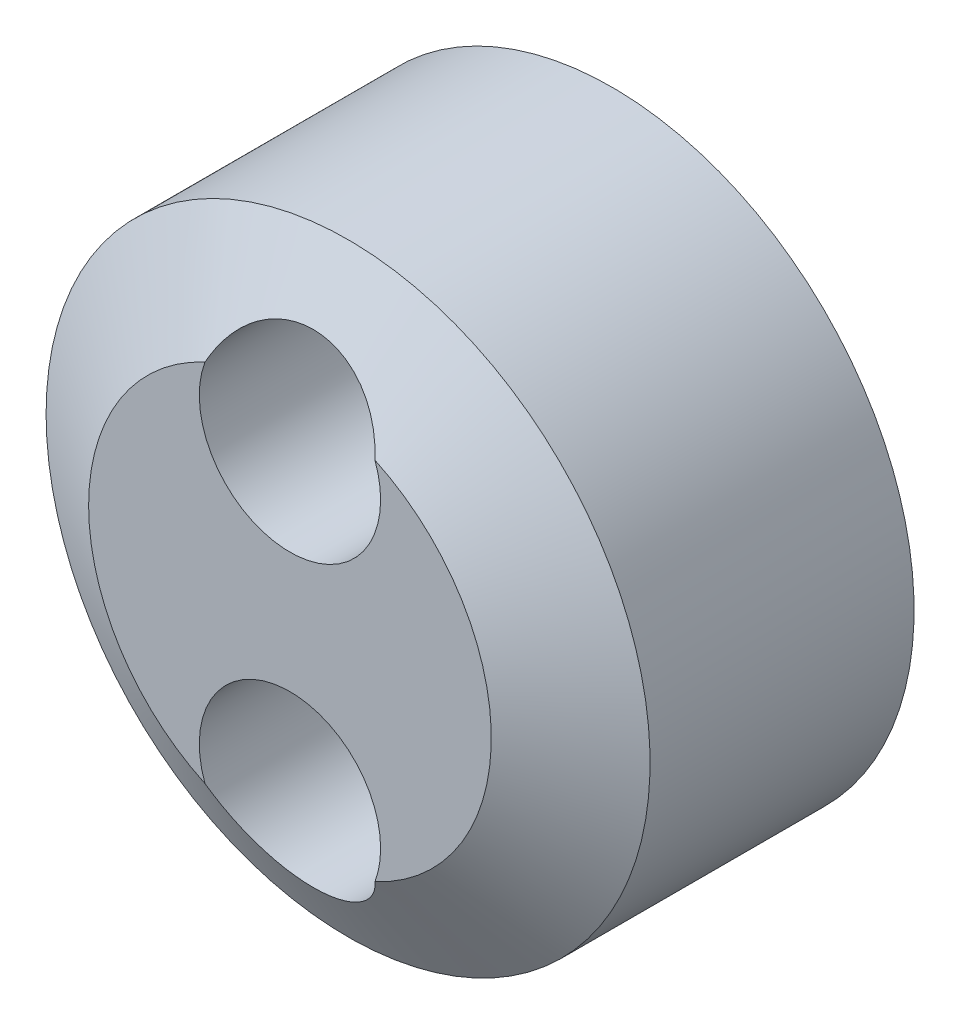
SolidWorks part; units mm, degrees
ref_plane "Plan de face" through (0, 0, 0) normal (0, 0, 1) x (1, 0, 0)
ref_plane "Plan de dessus" through (0, 0, 0) normal (0, 1, 0) x (1, 0, 0)
ref_plane "Plan de droite" through (0, 0, 0) normal (1, 0, 0) x (0, 0, -1)
sketch "Esquisse1" plane through (0, 0, 0) normal (0, 0, 1) x (1, 0, 0)
  circle A0 centre (0, 0) radius 30
  dimension "D1" = 60
extrude "Extrusion1" add sketch "Esquisse1" along normal blind 32
hole_wizard "Chambrage pour vis à tête hexagonale à filetage réduit M81" positions "Esquisse3" profile "Esquisse2" counterbore size "M8" standard "Ansi Métrique"
sketch "Esquisse3" plane through (0, 0, 32) normal (0, 0, 1) x (1, 0, 0)
  point P0 (0, 15)
  point P1 (0, -15)
  dimension "D1" = 30
  dimension "D2" = 15
sketch "Esquisse2" plane through (0, 15, 32) normal (1, 0, 0) x (0, -1, 0)
  line L0 (0, 0) -> (0, 32)
  line L1 (0, 32) -> (4.5, 32)
  line L3 (4.5, 32) -> (4.5, 22)
  line L4 (4.5, 22) -> (9.005, 22)
  line L5 (9.005, 22) -> (9.005, 0)
  line L7 (9.005, 0) -> (0, 0)
  line L11 (0, -6.35) -> (0, 107.95) construction
  dimension "Diamètre du perçage jusqu'au prochain" = 9
  dimension "Profondeur du perçage jusqu'au prochain" = 32
  dimension "Diamètre du chambrage" = 18.01
  dimension "Profondeur du chambrage" = 22
chamfer "Chanfrein1" distance 10 angle 30 1 edges at (30, 0, 32)
equation "\"D2@Esquisse3\" = \"D1@Esquisse3\" / 2"
